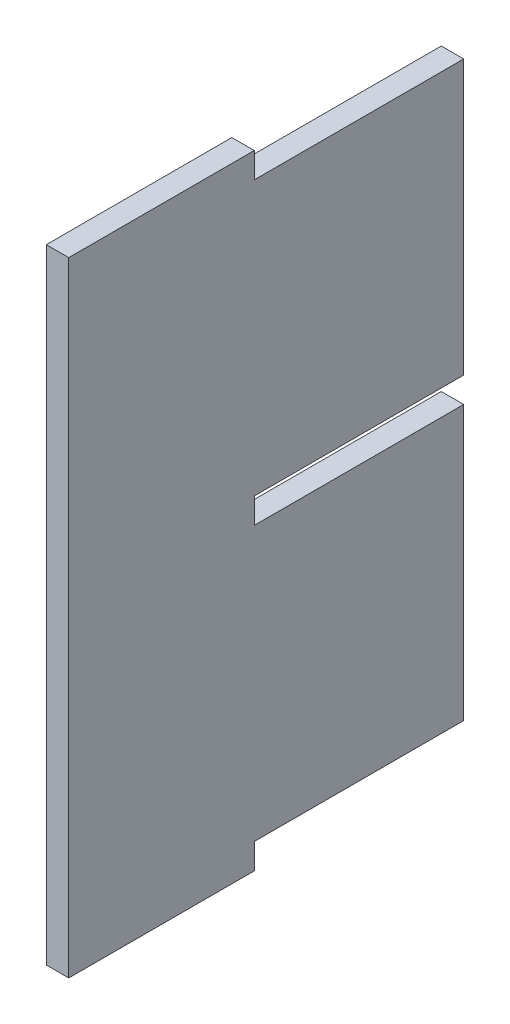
SolidWorks part; units mm, degrees
ref_plane "Alzado" through (0, 0, 0) normal (0, 0, 1) x (1, 0, 0)
ref_plane "Planta" through (0, 0, 0) normal (0, 1, 0) x (1, 0, 0)
ref_plane "Vista lateral" through (0, 0, 0) normal (1, 0, 0) x (0, 0, -1)
sketch "Croquis16" plane through (0, 0, 0) normal (0, 0, 1) x (1, 0, 0)
  line L0 (-18.25, -39.75) -> (-16.75, -39.75)
  line L1 (-18.5, -40) -> (-16.5, -40) construction
  line L2 (-18.5, -40) -> (-18.5, 40) construction
  line L3 (-18.5, 40) -> (-16.5, 40) construction
  line L4 (-16.5, -40) -> (-16.5, 40) construction
  line L5 (-16.75, -39.75) -> (-16.75, 39.75)
  line L6 (-18.25, 39.75) -> (-16.75, 39.75)
  line L7 (-18.25, -39.75) -> (-18.25, 39.75)
  dimension "D1" = 0.25
extrude "Saliente-Extruir9" add sketch "Croquis16" along normal blind 26.4
sketch "Croquis20" plane through (-16.75, 0, 0) normal (1, 0, 0) x (0, 0, -1)
  line L1 (0, -20.85) -> (-14, -20.85)
  line L2 (0, -20.85) -> (0, -19.15)
  line L3 (0, -19.15) -> (-14, -19.15)
  line L4 (-14, -20.85) -> (-14, -19.15)
  line L10 (0, -0.85) -> (-14, -0.85)
  line L11 (0, -0.85) -> (0, 0.85)
  line L12 (0, 0.85) -> (-14, 0.85)
  line L13 (-14, -0.85) -> (-14, 0.85)
  line L14 (0, 19.15) -> (-14, 19.15)
  line L15 (0, 19.15) -> (0, 20.85)
  line L16 (0, 20.85) -> (-14, 20.85)
  line L17 (-14, 19.15) -> (-14, 20.85)
  line L22 (0, -39.75) -> (0, 39.75) construction
  dimension "D1" = 1.7
  dimension "D2" = 14
  dimension "D4" = 1.7
  dimension "D5" = 1.7
  dimension "D6" = 14
  dimension "D7" = 14
extrude "Cortar-Extruir2" cut sketch "Croquis20" against normal up to surface (1.5 mm away)
sketch "Croquis21" plane through (-16.75, 0, 0) normal (1, 0, 0) x (0, 0, -1)
  line L0 (0, -20.85) -> (-14, -20.85) construction
  line L1 (0, -20.85) -> (-26.4, -20.85)
  line L2 (0, -20.85) -> (0, -39.75)
  line L3 (0, -39.75) -> (-26.4, -39.75)
  line L4 (-26.4, -20.85) -> (-26.4, -39.75)
  line L7 (0, 39.75) -> (-26.4, 39.75)
  line L8 (0, 39.75) -> (0, 20.85)
  line L9 (0, 20.85) -> (-26.4, 20.85)
  line L10 (-26.4, 39.75) -> (-26.4, 20.85)
extrude "Cortar-Extruir3" cut sketch "Croquis21" against normal up to surface (1.5 mm away)
